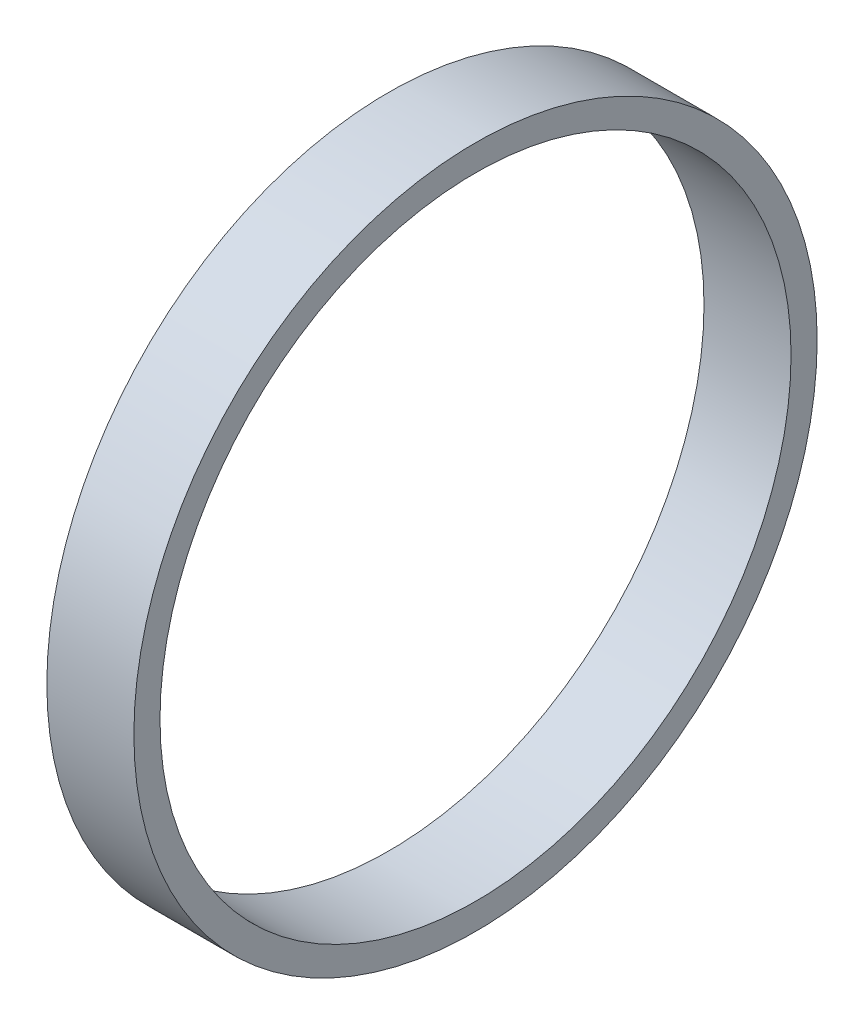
SolidWorks part; units mm, degrees
ref_plane "Face" through (0, 0, 0) normal (0, 0, 1) x (1, 0, 0)
ref_plane "Dessus" through (0, 0, 0) normal (0, 1, 0) x (1, 0, 0)
ref_plane "Droite" through (0, 0, 0) normal (1, 0, 0) x (0, 0, -1)
sketch "Esquisse1" plane through (0, 0, 0) normal (0, 0, 1) x (1, 0, 0)
  line L0 (0, 0) -> (14.114, 0) construction
  line L1 (0, 29) -> (8, 29)
  line L2 (0, 29) -> (0, 31.4)
  line L3 (0, 31.4) -> (8, 31.4)
  line L4 (8, 29) -> (8, 31.4)
  dimension "D1" = 29
  dimension "D2" = 31.4
  dimension "D3" = 8
revolve "Révolution1" add sketch "Esquisse1" angle 360 about L0
